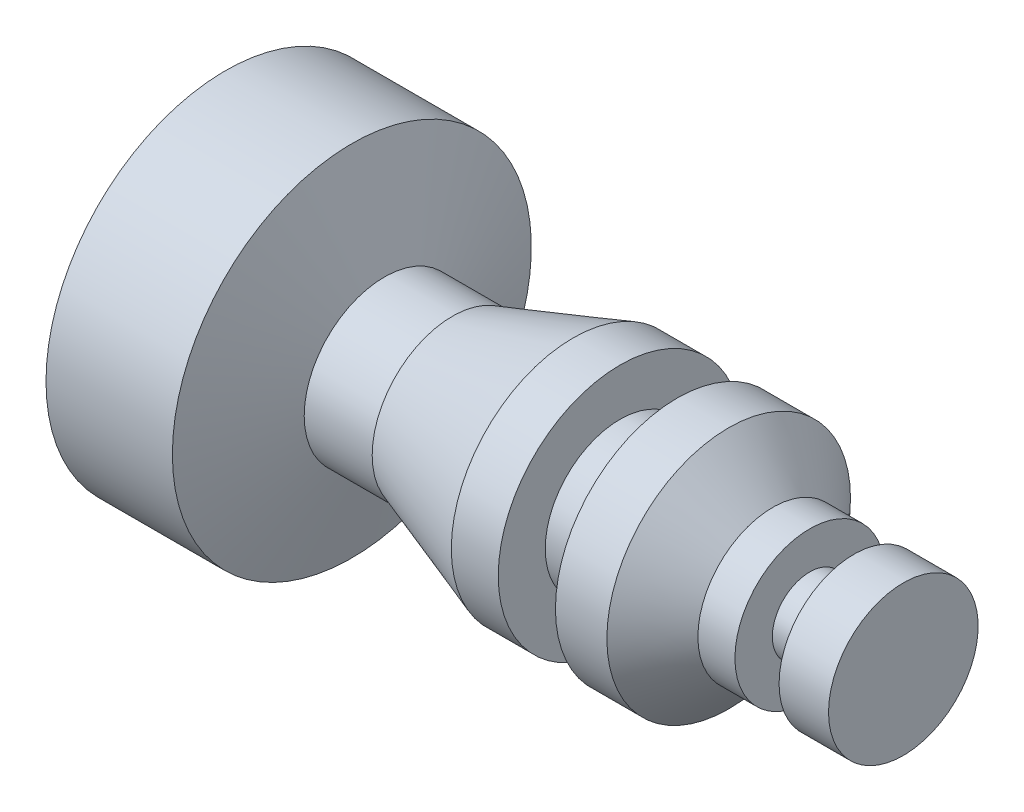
SolidWorks part; units mm, degrees
ref_plane "Front Plane" through (0, 0, 0) normal (0, 0, 1) x (1, 0, 0)
ref_plane "Top Plane" through (0, 0, 0) normal (0, 1, 0) x (1, 0, 0)
ref_plane "Right Plane" through (0, 0, 0) normal (1, 0, 0) x (0, 0, -1)
sketch "Sketch1" plane through (0, 0, 0) normal (0, 0, 1) x (1, 0, 0)
  line L0 (0, 0) -> (90.6656, 0) construction
  line L1 (0, 0) -> (0, 172.6997)
  line L2 (0, 172.6997) -> (121.6085, 172.6997)
  line L3 (121.6085, 172.6997) -> (152.9633, 77.2103)
  line L4 (152.9633, 77.2103) -> (218.3883, 77.2103)
  line L5 (218.3883, 77.2103) -> (334.5241, 117.2126)
  line L6 (334.5241, 117.2126) -> (379.688, 117.2126)
  line L7 (484.2101, 117.2126) -> (526.5568, 71.9826)
  line L8 (526.5568, 71.9826) -> (562.19, 71.9826)
  line L9 (652.273, 71.9826) -> (652.273, 0)
  line L10 (652.273, 0) -> (0, 0)
  line L11 (379.688, 117.2126) -> (379.688, 71.9826)
  line L12 (379.688, 71.9826) -> (434.714, 71.9826)
  line L13 (434.714, 71.9826) -> (434.714, 117.2126)
  line L14 (434.714, 117.2126) -> (484.2101, 117.2126)
  line L15 (562.19, 71.9826) -> (562.19, 35.9913)
  line L16 (562.19, 35.9913) -> (604.682, 35.9913)
  line L17 (604.682, 35.9913) -> (604.682, 71.9826)
  line L18 (604.682, 71.9826) -> (652.273, 71.9826)
revolve "Revolve1" add sketch "Sketch1" angle 360 about L0
scale "Scale1" scale about centroid uniform scaling yes scale factor 0.2
